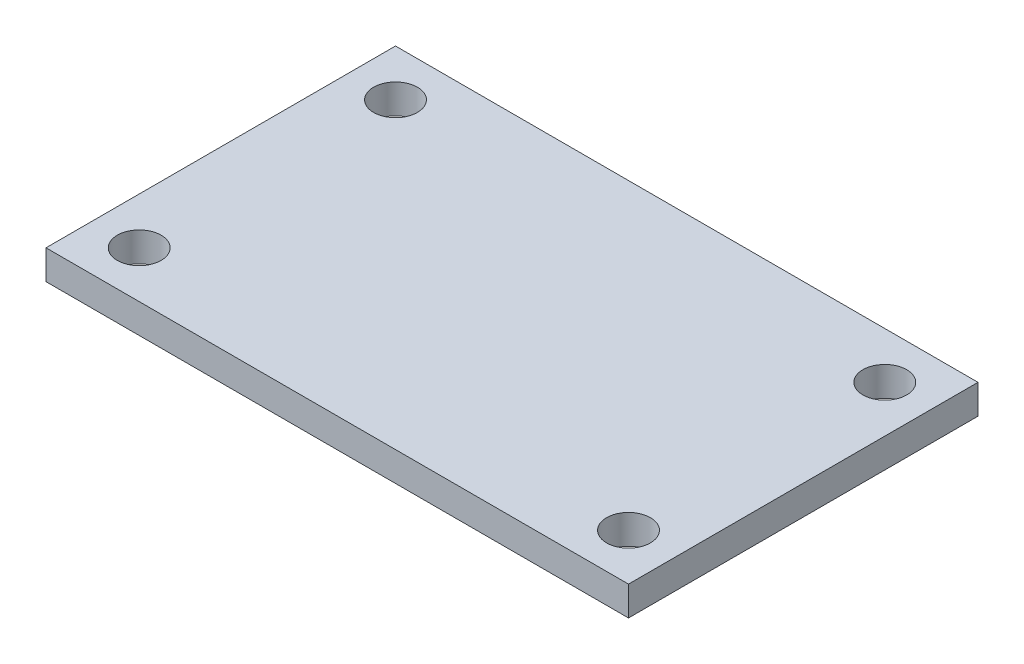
SolidWorks part; units mm, degrees
ref_plane "Front Plane" through (0, 0, 0) normal (0, 0, 1) x (1, 0, 0)
ref_plane "Top Plane" through (0, 0, 0) normal (0, 1, 0) x (1, 0, 0)
ref_plane "Right Plane" through (0, 0, 0) normal (1, 0, 0) x (0, 0, -1)
sketch "Sketch1" plane through (0, 0, 0) normal (0, 1, 0) x (1, 0, 0)
  line L0 (0, 0) -> (0, 50000) construction
  line L1 (-15.875, -9.525) -> (15.875, -9.525)
  line L2 (-15.875, -9.525) -> (-15.875, 9.525)
  line L3 (-15.875, 9.525) -> (15.875, 9.525)
  line L4 (15.875, -9.525) -> (15.875, 9.525)
  line L5 (-15.875, -9.525) -> (15.875, 9.525) construction
  line L6 (-15.875, 9.525) -> (15.875, -9.525) construction
  line L7 (0, 0) -> (50000, 0) construction
  circle A0 centre (13.335, 6.985) radius 1.1938
  circle A1 centre (13.335, -6.985) radius 1.1938
  circle A2 centre (-13.335, -6.985) radius 1.1938
  circle A3 centre (-13.335, 6.985) radius 1.1938
  point P0 (0, 0)
  dimension "D3" = 2.3876
  dimension "D4" = 2.54
  dimension "D5" = 2.54
  dimension "D1" = 31.75
  dimension "D2" = 19.05
extrude "Boss-Extrude1" add sketch "Sketch1" along normal blind 1.6
